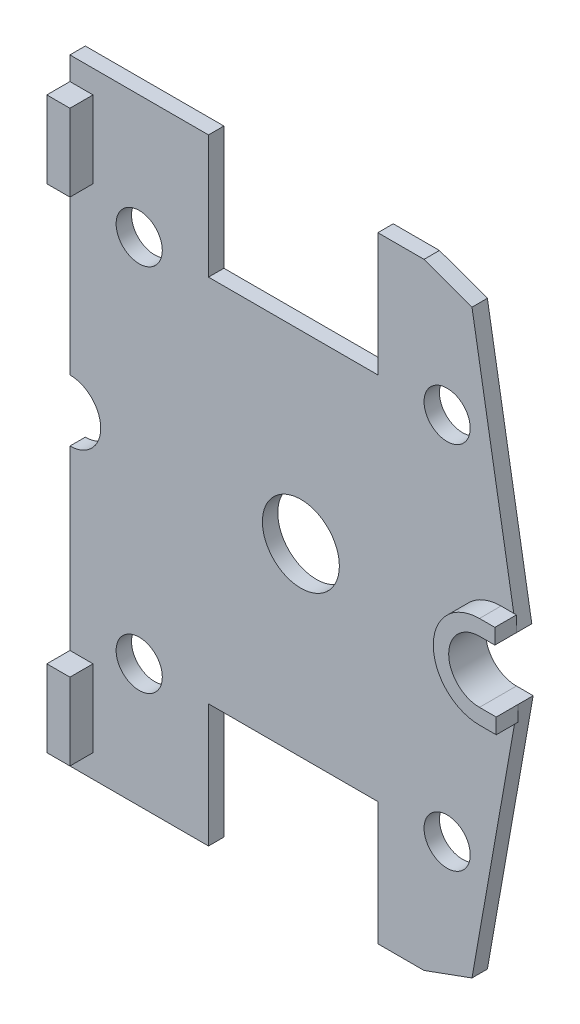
SolidWorks part; units mm, degrees
ref_plane "Plan1" through (0, 0, 0) normal (0, 0, 1) x (1, 0, 0)
ref_plane "Plan2" through (0, 0, 0) normal (0, 1, 0) x (1, 0, 0)
ref_plane "Plan3" through (0, 0, 0) normal (1, 0, 0) x (0, 0, -1)
sketch "Esquisse2" plane through (0, 0, 0) normal (0, 0, 1) x (1, 0, 0)
  line L0 (20, 0) -> (23, 0)
  line L1 (0, 0) -> (9, 0)
  line L2 (0, 0) -> (0, 18)
  line L3 (23, 40) -> (26.1141, 38.8665)
  line L4 (29, 22) -> (26.1141, 38.8665)
  line L5 (9, 8) -> (20, 8)
  line L6 (9, 8) -> (9, 0)
  line L7 (-10, 20) -> (12.5, 20) construction
  line L8 (20, 8) -> (20, 0)
  line L9 (20, 32) -> (20, 40)
  line L10 (9, 32) -> (9, 40)
  line L11 (29.0882, 18) -> (26.1141, 1.1335)
  line L12 (9, 32) -> (20, 32)
  line L13 (23, 0) -> (26.1141, 1.1335)
  line L14 (0, 40) -> (0, 22)
  line L15 (0, 40) -> (9, 40)
  line L16 (20, 40) -> (23, 40)
  line L17 (28, 22) -> (29, 22)
  line L18 (28, 18) -> (29.0882, 18)
  circle A0 centre (15, 20) radius 2.5
  arc A1 (0, 18) -> (0, 22) centre (0, 20) ccw
  arc A2 (28, 22) -> (28, 18) centre (28, 20) ccw
  dimension "D1" = 28
  dimension "D7" = 5
  dimension "D8" = 15
  dimension "D9" = 4
  dimension "D10" = 4
  dimension "D2" = 10
  dimension "D3" = 9
  dimension "D4" = 11
  dimension "D5" = 8
  dimension "D6" = 20
  dimension "D13" = 20
extrude "Base-Extrusion" add sketch "Esquisse2" along normal blind 1
sketch "Esquisse3" plane through (0, 0, 1) normal (0, 0, 1) x (1, 0, 0)
  line L0 (0, 18) -> (0, 0) construction
  circle A0 centre (4.5, 8) radius 1.5
  dimension "D1" = 4.5
  dimension "D2" = 3
  dimension "D3" = 8
extrude "Enlèv. mat.-Extru.1" cut sketch "Esquisse3" against normal through all
pattern_linear "Répétition linéaire1" count 2 spacing 24 count 2 spacing 20
sketch "Esquisse4" plane through (0, 0, 1) normal (0, 0, 1) x (1, 0, 0)
  line L0 (9, 40) -> (0, 40) construction
  line L1 (0, 38.5) -> (1.5, 38.5)
  line L2 (0, 38.5) -> (0, 33.5)
  line L3 (0, 33.5) -> (1.5, 33.5)
  line L4 (1.5, 38.5) -> (1.5, 33.5)
  line L5 (0, 0) -> (9, 0) construction
  line L6 (0, 40) -> (0, 22) construction
  line L7 (1.5, 1.5) -> (1.5, 6.5)
  line L8 (0, 6.5) -> (1.5, 6.5)
  line L9 (0, 1.5) -> (0, 6.5)
  line L10 (0, 1.5) -> (1.5, 1.5)
  dimension "D1" = 1.5
  dimension "D2" = 5
  dimension "D3" = 1.5
  dimension "D4" = 1.5
  dimension "D5" = 1.5
extrude "Boss.-Extru.1" add sketch "Esquisse4" along normal blind 1.5
ref_plane "Plan4" through (0, 20, 0) normal (0, 1, 0) x (-1, 0, 0)
sketch "Esquisse5" plane through (0, 0, 1) normal (0, 0, 1) x (1, 0, 0)
  line L0 (28, 22) -> (29, 22) construction
  line L1 (28, 22) -> (29, 22)
  line L2 (29.0882, 18) -> (28, 18) construction
  line L3 (29.0882, 18) -> (28, 18)
  arc A0 (28, 22) -> (28, 18) centre (28, 20) ccw construction
  arc A1 (28, 22) -> (28, 18) centre (28, 20) ccw
extrude "Boss.-Extru.-Mince1" add sketch "Esquisse5" along normal blind 1.4 thin
